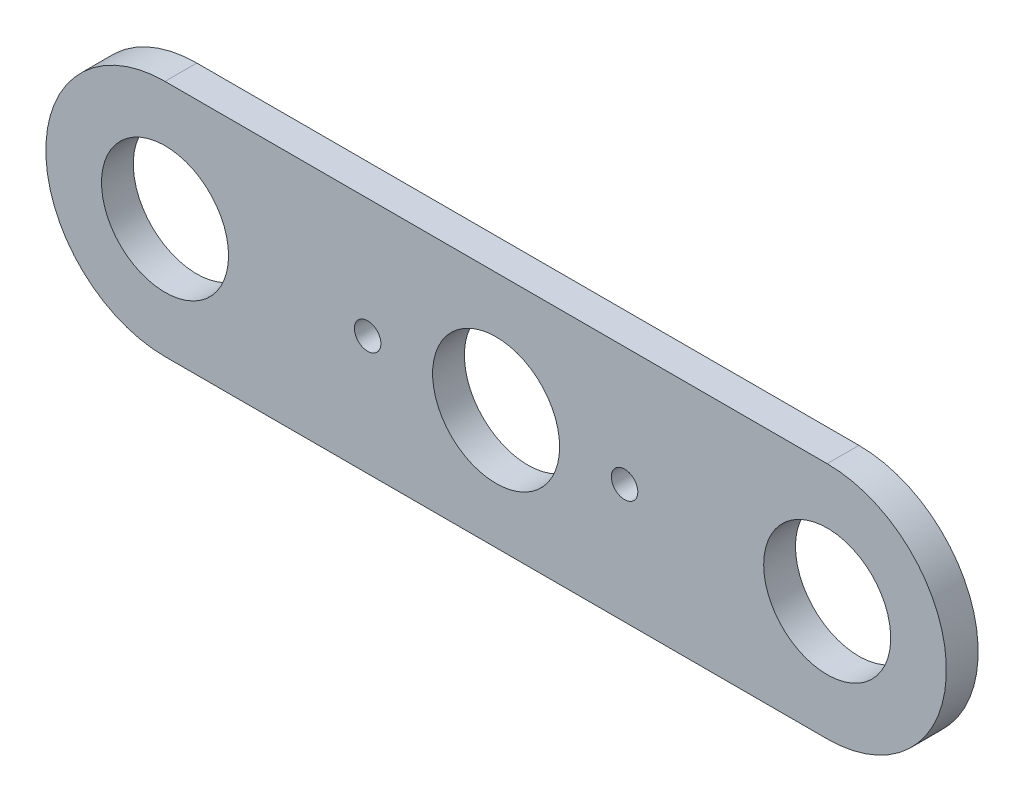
SolidWorks part; units mm, degrees
ref_plane "Front Plane" through (0, 0, 0) normal (0, 0, 1) x (1, 0, 0)
ref_plane "Top Plane" through (0, 0, 0) normal (0, 1, 0) x (1, 0, 0)
ref_plane "Right Plane" through (0, 0, 0) normal (1, 0, 0) x (0, 0, -1)
sketch "Sketch2" plane through (0, 0, 0) normal (0, 0, 1) x (1, 0, 0)
  line L0 (0, 22.5) -> (0, -22.5) construction
  line L1 (-62.5, -22.5) -> (62.5, -22.5)
  line L3 (-62.5, 22.5) -> (62.5, 22.5)
  line L5 (-62.5, -22.5) -> (62.5, 22.5) construction
  line L6 (-62.5, 22.5) -> (62.5, -22.5) construction
  arc A0 (62.5, -22.5) -> (62.5, 22.5) centre (62.5, 0) ccw
  arc A1 (-62.5, -22.5) -> (-62.5, 22.5) centre (-62.5, 0) cw
  circle A2 centre (-62.5, 0) radius 11.99
  circle A4 centre (62.5, 0) radius 11.99
  circle A5 centre (0, 0) radius 11.99
  point P0 (0, 0)
  dimension "D3" = 23.98
  dimension "D4" = 23.98
  dimension "D1" = 45
  dimension "D2" = 125
extrude "Boss-Extrude1" add sketch "Sketch2" along normal blind 6
sketch "Sketch3" plane through (0, 0, 6) normal (0, 0, 1) x (1, 0, 0)
  line L0 (-62.5, 0) -> (0, 0) construction
  line L1 (0, -1000) -> (0, 49000) construction
  circle A0 centre (-24.25, 0) radius 2.5
  circle A1 centre (24.25, 0) radius 2.5
  point P10 (0, 0)
  point P11 (0, 0)
  dimension "D1" = 5
  dimension "D2" = 24.25
extrude "Cut-Extrude1" cut sketch "Sketch3" against normal blind 10
